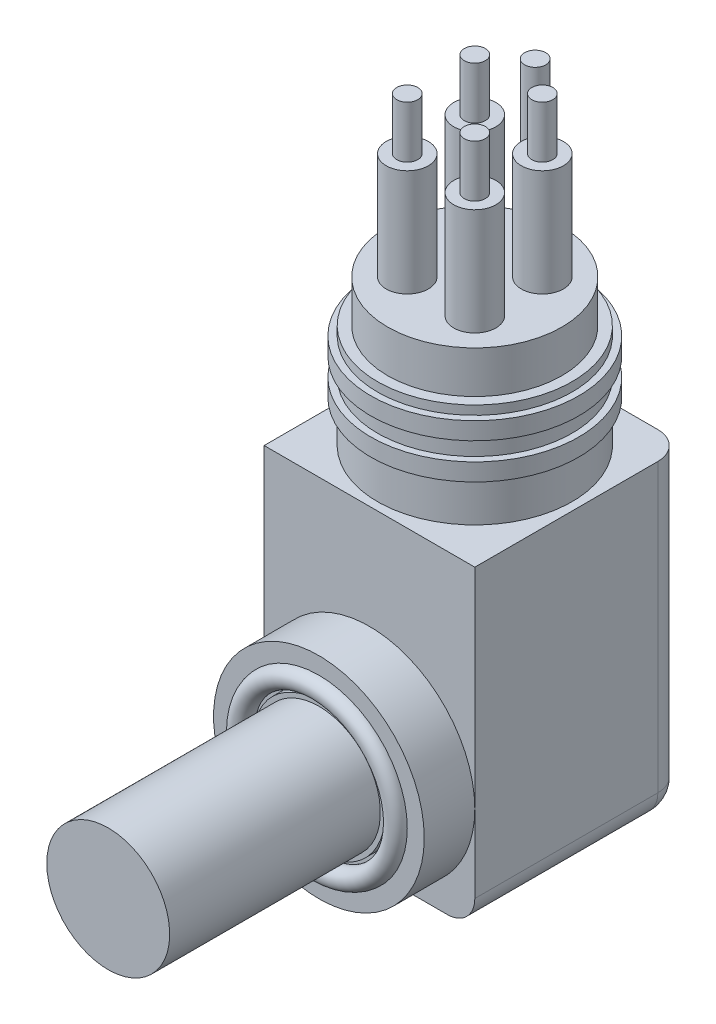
SolidWorks part; units mm, degrees
ref_plane "Front" through (0, 0, 0) normal (0, 0, 1) x (1, 0, 0)
ref_plane "Top" through (0, 0, 0) normal (0, 1, 0) x (1, 0, 0)
ref_plane "Right" through (0, 0, 0) normal (1, 0, 0) x (0, 0, -1)
sketch "Sketch1" plane through (0, 0, 0) normal (0, 1, 0) x (1, 0, 0)
  line L0 (9.525, -9.525) -> (-9.525, 9.525) construction
  line L1 (0, 10.9985) -> (-9.525, 5.4993) construction
  line L2 (-9.525, 5.4993) -> (-9.525, -5.4993) construction
  line L3 (-9.525, -5.4993) -> (0, -10.9985) construction
  line L4 (0, -10.9985) -> (9.525, -5.4993) construction
  line L5 (9.525, -5.4993) -> (9.525, 5.4993) construction
  line L6 (9.525, 5.4993) -> (0, 10.9985) construction
  line L7 (-9.525, 9.525) -> (9.525, 9.525)
  line L8 (-9.525, 9.525) -> (-9.525, -9.525)
  line L9 (-9.525, -9.525) -> (9.525, -9.525)
  line L10 (9.525, 9.525) -> (9.525, -9.525)
  circle A0 centre (0, 0) radius 9.525 construction
  dimension "D1" = 19.05
  dimension "D2" = 19.05
  dimension "D3" = 19.05
extrude "Extrude1" add sketch "Sketch1" along normal blind 28.448
sketch "Sketch2" plane through (0, 0, 0) normal (0, 0, 1) x (1, 0, 0)
  line L0 (0, 0) -> (0, -1.8388) construction
  line L1 (8.8011, 28.448) -> (8.8011, 32.2326)
  line L3 (8.8011, 32.2326) -> (9.398, 32.2326)
  line L4 (9.398, 32.2326) -> (9.398, 33.8074)
  line L5 (9.398, 33.8074) -> (8.8011, 33.8074)
  line L6 (8.8011, 33.8074) -> (8.8011, 35.4584)
  line L7 (8.8011, 35.4584) -> (9.398, 35.4584)
  line L8 (9.398, 35.4584) -> (9.398, 37.0332)
  line L9 (9.398, 37.0332) -> (8.8011, 37.0332)
  line L10 (8.8011, 37.0332) -> (8.8011, 37.846)
  line L11 (8.8011, 37.846) -> (0, 37.846)
  line L12 (0, 37.846) -> (0, 28.448)
  line L13 (-9.398, 32.2326) -> (-9.398, 33.8074) construction
  line L14 (-8.8011, 28.448) -> (-8.8011, 32.2326) construction
  line L15 (8.8011, 28.448) -> (0, 28.448)
  line L16 (9.525, 28.448) -> (-9.525, 28.448) construction
  dimension "D1" = 17.6022
  dimension "D2" = 18.796
  dimension "D3" = 1.5748
  dimension "D4" = 1.651
  dimension "D5" = 0.8128
  dimension "D6" = 9.398
revolve "Revolve1" add sketch "Sketch2" angle 360 about L0
sketch "Sketch3" plane through (0, 37.846, 0) normal (0, 1, 0) x (-1, 0, 0)
  circle A0 centre (0, 0) radius 7.874
  dimension "D1" = 15.748
extrude "Extrude2" add sketch "Sketch3" along normal blind 3.81
sketch "Sketch4" plane through (0, 41.656, 0) normal (0, 1, 0) x (-1, 0, 0)
  line L0 (0, 0) -> (0, 8.4348) construction
  line L1 (0, 0) -> (3.0533, 3.0533) construction
  circle A0 centre (3.0533, 3.0533) radius 1.905
  circle A1 centre (0, 0) radius 4.318 construction
  dimension "D1" = 3.81
  dimension "D2" = 8.636
  dimension "D3" = 45
extrude "Extrude3" add sketch "Sketch4" along normal blind 9.652
sketch "Sketch5" plane through (0, 51.308, 0) normal (0, 1, 0) x (-1, 0, 0)
  circle A0 centre (3.0533, 3.0533) radius 0.9525
  circle A1 centre (3.0533, 3.0533) radius 1.905 construction
  dimension "D1" = 1.905
extrude "Extrude4" add sketch "Sketch5" along normal blind 4.699
pattern_circular "CirPattern1" count 4 every 90 about axis through (0, 0, 0) along (0, 1, 0) of "Extrude3", "Extrude4"
sketch "1" plane through (0.0995, 41.656, 4.4802) normal (0, 1, 0) x (-1, 0, 0)
  circle A0 centre (0.0995, -9.9384) radius 0.9525
  dimension "D1" = 1.905
extrude "Extrude5" add sketch "1" along normal up to surface (14.351 mm away)
sketch "2" plane through (0.0995, 56.007, 4.4802) normal (0, 1, 0) x (-1, 0, 0)
  circle A0 centre (0.0995, -4.4802) radius 0.9906
  dimension "D1" = 1.9812
sketch "Sketch10" plane through (0, 0, 9.525) normal (0, 0, 1) x (1, 0, 0)
  line L0 (-9.525, 0) -> (9.525, 0) construction
  circle A0 centre (0, 9.525) radius 9.525
  dimension "D1" = 19.05
extrude "Extrude8" add sketch "Sketch10" along normal blind 4.572
sketch "Sketch11" plane through (0, 0, 14.097) normal (0, 0, 1) x (1, 0, 0)
  circle A0 centre (0, 9.525) radius 7.9885
  circle A1 centre (0, 9.525) radius 5.9565
  circle A2 centre (0, 9.525) radius 9.525 construction
  dimension "D1" = 15.977
  dimension "D2" = 11.913
extrude "Cut-Extrude1" cut sketch "Sketch11" against normal blind 1.27
sketch "Sketch8" plane through (0, 12.8, 14.097) normal (0, 0, -1) x (1, 0, 0)
  circle A0 centre (0, 3.275) radius 5.5562
  circle A1 centre (0, 3.275) radius 9.525 construction
  dimension "D1" = 11.1125
extrude "Extrude7" add sketch "Sketch8" against normal blind 19.05
sketch "Sketch9" plane through (0, -0.126, 0.126) normal (1, 0, 0) x (0, 1, 0)
  line L0 (9.651, 13.1375) -> (9.651, 9.5261) construction
  line L1 (19.176, 13.971) -> (0.126, 13.971) construction
  line L2 (9.651, 13.971) -> (9.651, 9.399) construction
  circle A0 centre (16.751, 13.971) radius 0.89
  circle A1 centre (2.551, 13.971) radius 0.89 construction
  dimension "D1" = 1.78
  dimension "D2" = 12.42
revolve "o-ring 12.42x1.78" add sketch "Sketch9" angle 360 about L0
fillet "Fillet1" radius 2.5 5 edges at (9.525, 0, 0) (0, 0, -9.525) (-9.525, 0, 0) (-9.525, 14.224, -9.525) (9.525, 14.224, -9.525)
